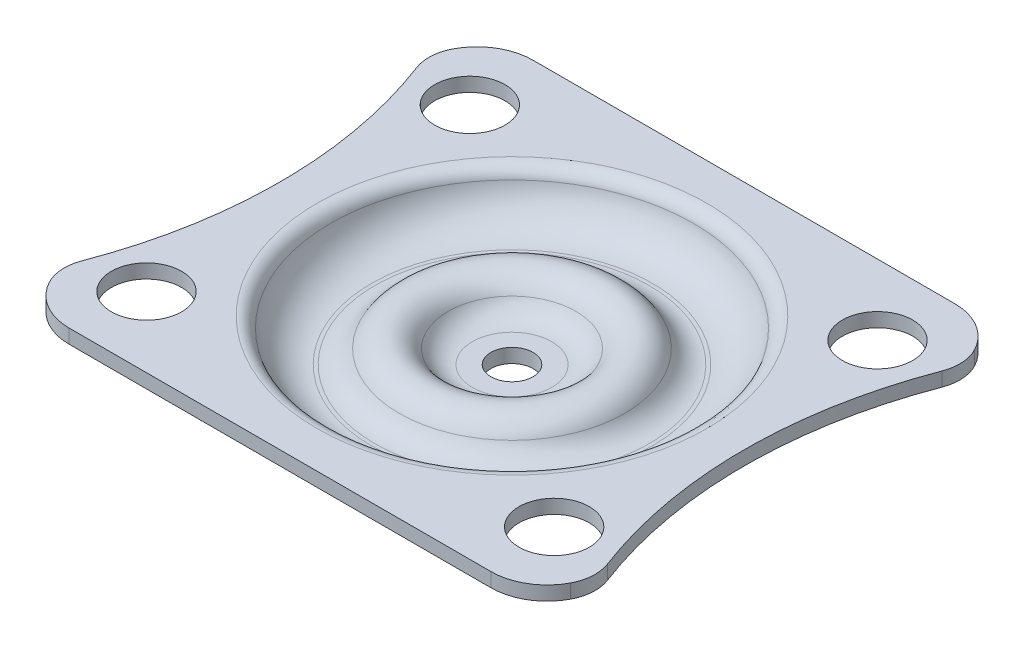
SolidWorks part; units mm, degrees
ref_plane "Plan de face" through (0, 0, 0) normal (0, 0, 1) x (1, 0, 0)
ref_plane "Plan de dessus" through (0, 0, 0) normal (0, 1, 0) x (1, 0, 0)
ref_plane "Plan de droite" through (0, 0, 0) normal (1, 0, 0) x (0, 0, -1)
sketch "Esquisse1" plane through (0, 0, 0) normal (0, 0, 1) x (1, 0, 0)
  line L0 (0, 5.3737) -> (0, -9.2525) construction
  line L1 (-32.9841, 0) -> (18.5715, 0) construction
  line L2 (-32.9841, -3) -> (18.5715, -3) construction
  line L3 (-15, 0) -> (-13.873, 0)
  line L4 (-10, -3) -> (-9.75, -3)
  line L5 (-2.8218, -3) -> (-1.5, -3)
  arc A0 (-12.9047, -0.75) -> (-10, -3) centre (-10, 0) ccw
  arc A1 (-4.5538, -2) -> (-8.0179, -2) centre (-6.2859, -3) ccw
  arc A2 (-13.873, 0) -> (-12.9047, -0.75) centre (-13.873, -1) cw
  arc A3 (-9.75, -3) -> (-8.0179, -2) centre (-9.75, -1) ccw
  arc A4 (-4.5538, -2) -> (-2.8218, -3) centre (-2.8218, -1) ccw
  point P18 (-13, 0)
  point P19 (-8.2859, -3)
  point P23 (-4.2859, -3)
  dimension "D4" = 1
  dimension "D5" = 4
  dimension "D6" = 2
  dimension "D7" = 2
  dimension "D1" = 3
  dimension "D2" = 13
  dimension "D3" = 15
  dimension "D8" = 0.25
  dimension "D9" = 1.5
revolve "Révol.-Mince1" add sketch "Esquisse1" angle 360 about L0
sketch "Esquisse2" plane through (0, 0, 0) normal (0, 1, 0) x (1, 0, 0)
  line L0 (-49.1973, 0) -> (54.8272, 0) construction
  line L1 (0, 22.0018) -> (0, -20.2016) construction
  line L2 (-15, 16.5) -> (15, 16.5)
  line L3 (-15, -16.5) -> (15, -16.5)
  circle A0 centre (0, 0) radius 15
  arc A1 (-18.6865, -11.9045) -> (-18.6865, 11.9045) centre (-50, 0) ccw
  arc A2 (-15, 16.5) -> (-18.5294, 14.3824) centre (-15, 12.5) ccw
  arc A3 (-18.6865, 11.9045) -> (-18.5294, 14.3824) centre (-15.8824, 12.9706) cw
  arc A4 (-18.6865, -11.9045) -> (-18.5294, -14.3824) centre (-15.8824, -12.9706) ccw
  arc A5 (-15, -16.5) -> (-18.5294, -14.3824) centre (-15, -12.5) cw
  arc A6 (18.6865, -11.9045) -> (18.5294, -14.3824) centre (15.8824, -12.9706) cw
  arc A7 (15, -16.5) -> (18.5294, -14.3824) centre (15, -12.5) ccw
  arc A8 (18.6865, -11.9045) -> (18.6865, 11.9045) centre (50, 0) cw
  arc A9 (18.6865, 11.9045) -> (18.5294, 14.3824) centre (15.8824, 12.9706) ccw
  arc A10 (15, 16.5) -> (18.5294, 14.3824) centre (15, 12.5) cw
  circle A11 centre (-14.5, 11.5) radius 2.5
  circle A12 centre (-14.5, -11.5) radius 2.5
  circle A13 centre (14.5, 11.5) radius 2.5
  circle A14 centre (14.5, -11.5) radius 2.5
  point P13 (-16.5, 0)
  point P27 (0, -16.5)
  point P37 (0, 16.5)
  dimension "D3" = 30
  dimension "D6" = 4
  dimension "D2" = 3
  dimension "D8" = 5
  dimension "D1" = 14.5
  dimension "D4" = 16.5
  dimension "D5" = 50
  dimension "D7" = 11.5
extrude "Boss.-Extru.1" add sketch "Esquisse2" against normal blind 1
